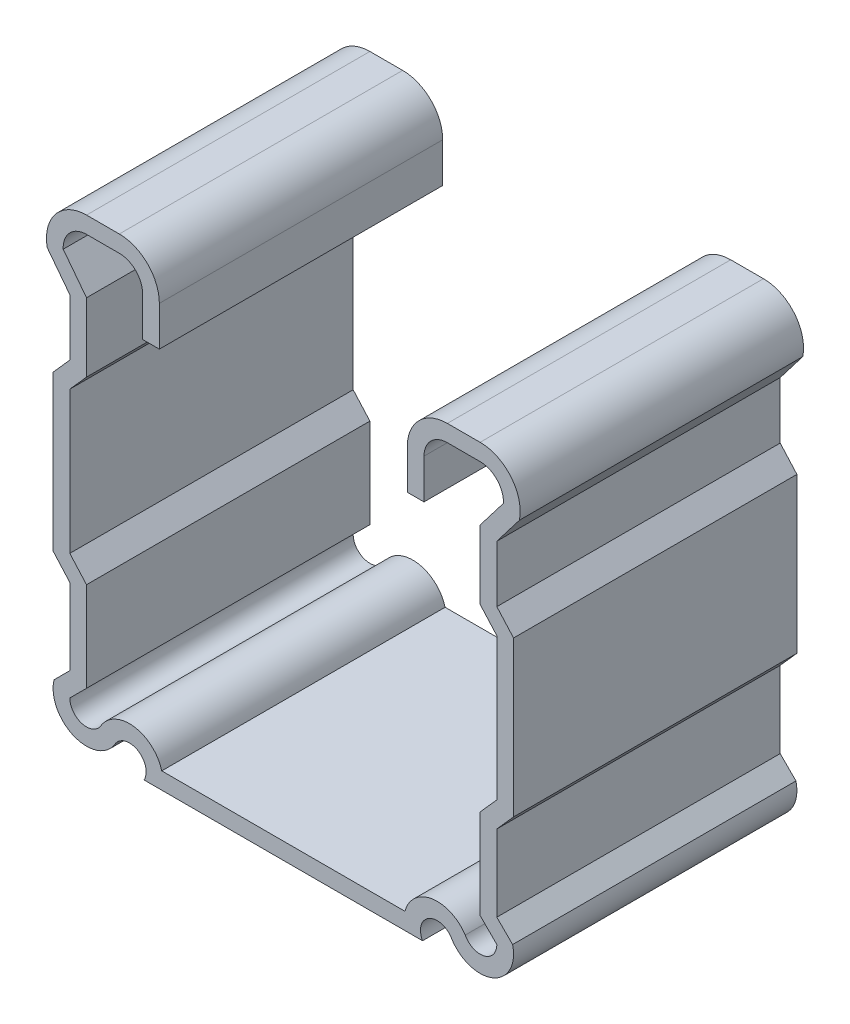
SolidWorks part; units mm, degrees
ref_plane "Plane1" through (0, 0, 0) normal (0, 0, 1) x (1, 0, 0)
ref_plane "Plane2" through (0, 0, 0) normal (0, 1, 0) x (1, 0, 0)
ref_plane "Plane3" through (0, 0, 0) normal (1, 0, 0) x (0, 0, -1)
other "Configuration Table"
sketch "Sketch1" plane through (0, 0, 0) normal (0, 0, 1) x (1, 0, 0)
  line L0 (17.6403, 16.3393) -> (19.7299, 19.0635)
  line L1 (17.6403, -13.9795) -> (19.1389, -15.4781)
  line L2 (-17.6403, -13.9795) -> (-19.1389, -15.4781)
  line L4 (-17.6403, -13.9795) -> (-17.6403, -5.9368)
  line L5 (17.6403, 21.2598) -> (14.7033, 21.2598)
  line L6 (12.6111, 19.1676) -> (12.6111, 15.6147)
  line L7 (-17.6403, -5.9368) -> (-19.1389, -4.2539)
  line L8 (-12.6111, 19.1676) -> (-12.6111, 15.6147)
  line L9 (0, 10.16) -> (0, -7.62) construction
  line L10 (-19.1389, -4.2539) -> (-19.1389, 8.4957)
  line L11 (-17.6403, 10.1786) -> (-19.1389, 8.4957)
  line L12 (-17.6403, 10.1786) -> (-17.6403, 16.3393)
  line L13 (-17.6403, 16.3393) -> (-19.7299, 19.0635)
  line L14 (-17.6403, 21.2598) -> (-14.7033, 21.2598)
  line L16 (17.6403, -13.9795) -> (17.6403, -5.9368)
  line L17 (17.6403, 10.1786) -> (17.6403, 16.3393)
  line L18 (-11.1125, 19.1676) -> (-11.1125, 15.6147)
  line L19 (-17.6403, 22.7584) -> (-14.7033, 22.7584)
  line L20 (-19.1389, 15.8307) -> (-21.1624, 18.4689)
  line L21 (-19.1389, 10.7491) -> (-19.1389, 15.8307)
  line L22 (-19.1389, 10.7491) -> (-20.6375, 9.0662)
  line L23 (-20.6375, -4.8244) -> (-20.6375, 9.0662)
  line L24 (-19.1389, -6.5073) -> (-20.6375, -4.8244)
  line L25 (19.1389, -4.2539) -> (19.1389, 8.4957)
  line L26 (-19.1389, -13.3588) -> (-19.1389, -6.5073)
  line L27 (-19.1389, -13.3588) -> (-20.5535, -14.7733)
  line L28 (11.1125, 19.1676) -> (11.1125, 15.6147)
  line L29 (17.6403, 22.7584) -> (14.7033, 22.7584)
  line L30 (19.1389, 15.8307) -> (21.1624, 18.4689)
  line L31 (19.1389, 10.7491) -> (19.1389, 15.8307)
  line L32 (19.1389, 10.7491) -> (20.6375, 9.0662)
  line L33 (20.6375, -4.8244) -> (20.6375, 9.0662)
  line L34 (19.1389, -6.5073) -> (20.6375, -4.8244)
  line L35 (19.1389, -13.3588) -> (19.1389, -6.5073)
  line L36 (19.1389, -13.3588) -> (20.5535, -14.7733)
  line L37 (17.6403, -5.9368) -> (19.1389, -4.2539)
  line L38 (-12.4806, -18.5166) -> (12.4806, -18.5166)
  line L39 (17.6403, 10.1786) -> (19.1389, 8.4957)
  line L41 (-10.899, -17.018) -> (10.899, -17.018)
  line L42 (-12.6111, 15.6147) -> (-11.1125, 15.6147)
  line L43 (11.1125, 15.6147) -> (12.6111, 15.6147)
  arc A0 (19.1389, -15.4781) -> (16.3052, -16.1588) centre (17.6403, -15.4781) cw
  arc A1 (16.3052, -16.1588) -> (10.899, -17.018) centre (13.7938, -17.7947) ccw
  arc A2 (-16.4143, -16.3399) -> (-10.899, -17.018) centre (-13.7938, -17.7947) cw
  arc A3 (-19.1389, -15.4781) -> (-16.4143, -16.3399) centre (-17.6403, -15.4781) ccw
  arc A4 (-17.6403, 21.2598) -> (-19.7299, 19.0635) centre (-17.6403, 19.1676) ccw
  arc A5 (-12.6111, 19.1676) -> (-14.7033, 21.2598) centre (-14.7033, 19.1676) ccw
  arc A6 (17.6403, 21.2598) -> (19.7299, 19.0635) centre (17.6403, 19.1676) cw
  arc A7 (12.6111, 19.1676) -> (14.7033, 21.2598) centre (14.7033, 19.1676) cw
  arc A8 (-11.1125, 19.1676) -> (-14.7033, 22.7584) centre (-14.7033, 19.1676) ccw
  arc A9 (-17.6403, 22.7584) -> (-21.1624, 18.4689) centre (-17.6403, 19.1676) ccw
  arc A10 (-20.5535, -14.7733) -> (-15.0198, -16.9329) centre (-17.6403, -15.4781) ccw
  arc A11 (11.1125, 19.1676) -> (14.7033, 22.7584) centre (14.7033, 19.1676) cw
  arc A12 (17.6403, 22.7584) -> (21.1624, 18.4689) centre (17.6403, 19.1676) cw
  arc A13 (20.5535, -14.7733) -> (15.0198, -16.9329) centre (17.6403, -15.4781) cw
  arc A14 (15.0198, -16.9329) -> (12.4806, -18.5166) centre (13.7938, -17.7947) ccw
  arc A15 (-15.0198, -16.9329) -> (-12.4806, -18.5166) centre (-13.7938, -17.7947) cw
  dimension "D9" = 7.1437
  dimension "base" = 18.5166
  dimension "D5" = 9.525
  dimension "ToeHt" = 22.7584
  dimension "D6" = 22.225
  dimension "D8" = 15.4781
  dimension "D12" = 41.275
  dimension "D14" = 13.6922
  dimension "D15" = 13.8906
extrude "Base-Extrude" add sketch "Sketch1" along normal mid plane 25.4
